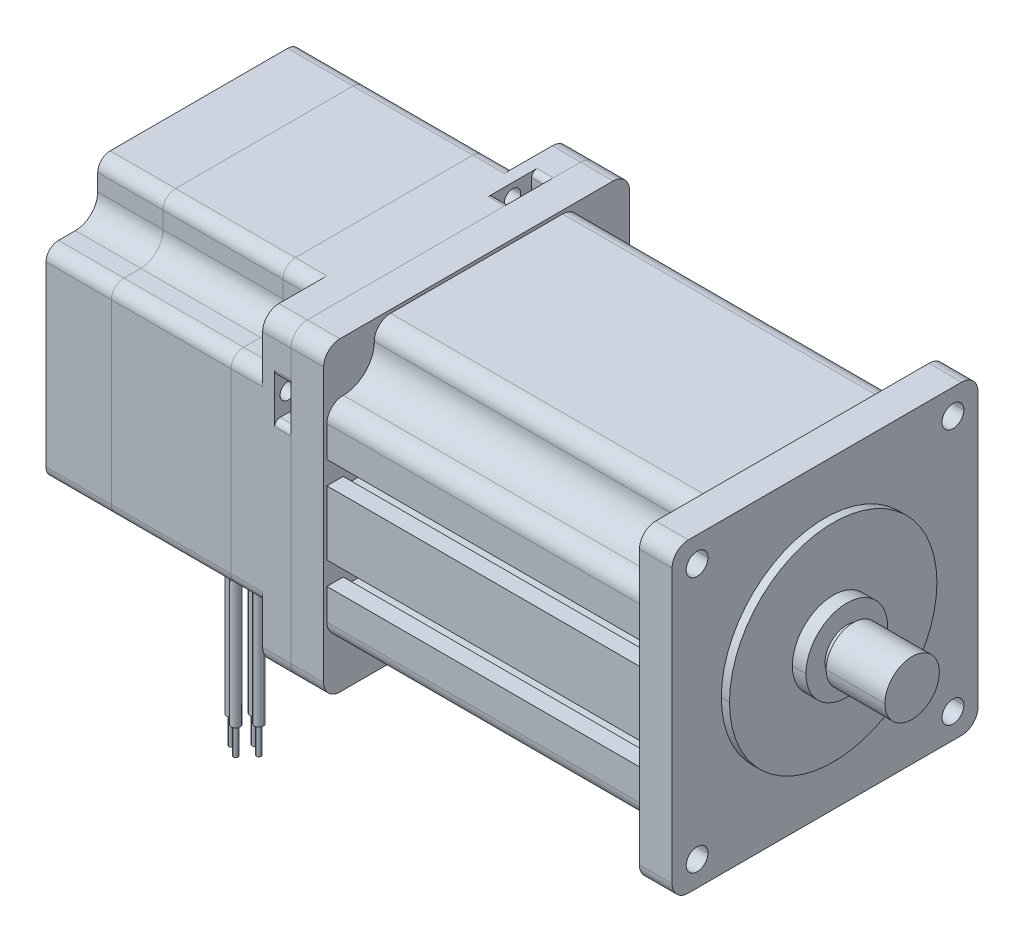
SolidWorks part; units mm, degrees
ref_plane "Front" through (0, 0, 0) normal (0, 0, 1) x (1, 0, 0)
ref_plane "Top" through (0, 0, 0) normal (0, 1, 0) x (1, 0, 0)
ref_plane "Right" through (0, 0, 0) normal (1, 0, 0) x (0, 0, -1)
imported_body "Imported1"
imported_body "Imported2"
imported_body "Imported3"
imported_body "Imported4"
surface "Surface-Plane1"
split "Split1" trim tools "Surface-Plane1" bodies to split 105 107 106 104 resulting bodies 109 110 111 112 113
move or copy body "Body-Move/Copy1" bodies to move or copy 112 placed by mates yes parameters "D1"=0, "D2"=0, "D3"=0
other "Distance1" parameters "D1"=58
sketch "Sketch1" plane through (22.6491, 0, 0) normal (1, 0, 0) x (0, 0, -1)
  line L36 (-39.9658, 49.7932) -> (-36.9658, 49.7932)
  line L37 (-36.9658, 49.7932) -> (-36.9658, 42.5932)
  line L38 (-36.9658, 42.5932) -> (-39.9658, 42.5932)
  line L39 (-39.9658, 42.5932) -> (-39.9658, 44.0932)
  line L40 (-39.9658, 44.0932) -> (-42.9658, 44.0932)
  line L41 (-42.9658, 44.0932) -> (-42.9658, 32.2932)
  line L42 (-42.9658, 32.2932) -> (-39.9658, 32.2932)
  line L43 (-39.9658, 32.2932) -> (-39.9658, 33.7932)
  line L44 (-39.9658, 33.7932) -> (-36.9658, 33.7932)
  line L45 (-36.9658, 33.7932) -> (-36.9658, 26.5932)
  line L46 (-36.9658, 26.5932) -> (-39.9658, 26.5932)
  line L47 (-39.9658, 26.5932) -> (-39.9658, 28.0932)
  line L48 (-39.9658, 28.0932) -> (-42.9658, 28.0932)
  line L49 (-42.9658, 28.0932) -> (-42.9658, 22.3932)
  line L50 (-31.2658, 10.6932) -> (0.3342, 10.6932)
  line L51 (12.0342, 22.3932) -> (12.0342, 28.0932)
  line L52 (12.0342, 28.0932) -> (9.0342, 28.0932)
  line L53 (9.0342, 28.0932) -> (9.0342, 26.5932)
  line L54 (9.0342, 26.5932) -> (6.0342, 26.5932)
  line L55 (6.0342, 26.5932) -> (6.0342, 33.7932)
  line L56 (6.0342, 33.7932) -> (9.0342, 33.7932)
  line L57 (9.0342, 33.7932) -> (9.0342, 32.2932)
  line L58 (9.0342, 32.2932) -> (12.0342, 32.2932)
  line L59 (12.0342, 32.2932) -> (12.0342, 44.0932)
  line L60 (12.0342, 44.0932) -> (9.0342, 44.0932)
  line L61 (9.0342, 44.0932) -> (9.0342, 42.5932)
  line L62 (9.0342, 42.5932) -> (6.0342, 42.5932)
  line L63 (6.0342, 42.5932) -> (6.0342, 49.7932)
  line L64 (6.0342, 49.7932) -> (9.0342, 49.7932)
  line L65 (9.0342, 49.7932) -> (9.0342, 48.2932)
  line L66 (9.0342, 48.2932) -> (12.0342, 48.2932)
  line L67 (12.0342, 48.2932) -> (12.0342, 53.9932)
  line L68 (0.3342, 65.6932) -> (-31.2658, 65.6932)
  line L69 (-42.9658, 53.9932) -> (-42.9658, 48.2932)
  line L70 (-42.9658, 48.2932) -> (-39.9658, 48.2932)
  line L71 (-39.9658, 48.2932) -> (-39.9658, 49.7932)
  line L72 (-39.9658, 49.7932) -> (-36.9658, 49.7932)
  line L73 (-36.9658, 49.7932) -> (-36.9658, 42.5932)
  line L74 (-36.9658, 42.5932) -> (-39.9658, 42.5932)
  line L75 (-39.9658, 42.5932) -> (-39.9658, 44.0932)
  line L76 (-39.9658, 44.0932) -> (-42.9658, 44.0932)
  line L77 (-42.9658, 44.0932) -> (-42.9658, 32.2932)
  line L78 (-42.9658, 32.2932) -> (-39.9658, 32.2932)
  line L79 (-39.9658, 32.2932) -> (-39.9658, 33.7932)
  line L80 (-39.9658, 33.7932) -> (-36.9658, 33.7932)
  line L81 (-36.9658, 33.7932) -> (-36.9658, 26.5932)
  line L82 (-36.9658, 26.5932) -> (-39.9658, 26.5932)
  line L83 (-39.9658, 26.5932) -> (-39.9658, 28.0932)
  line L84 (-39.9658, 28.0932) -> (-42.9658, 28.0932)
  line L85 (-42.9658, 28.0932) -> (-42.9658, 22.3932)
  line L86 (-31.2658, 10.6932) -> (0.3342, 10.6932)
  line L87 (12.0342, 22.3932) -> (12.0342, 28.0932)
  line L88 (12.0342, 28.0932) -> (9.0342, 28.0932)
  line L89 (9.0342, 28.0932) -> (9.0342, 26.5932)
  line L90 (9.0342, 26.5932) -> (6.0342, 26.5932)
  line L91 (6.0342, 26.5932) -> (6.0342, 33.7932)
  line L92 (6.0342, 33.7932) -> (9.0342, 33.7932)
  line L93 (9.0342, 33.7932) -> (9.0342, 32.2932)
  line L94 (9.0342, 32.2932) -> (12.0342, 32.2932)
  line L95 (12.0342, 32.2932) -> (12.0342, 44.0932)
  line L96 (12.0342, 44.0932) -> (9.0342, 44.0932)
  line L97 (9.0342, 44.0932) -> (9.0342, 42.5932)
  line L98 (9.0342, 42.5932) -> (6.0342, 42.5932)
  line L99 (6.0342, 42.5932) -> (6.0342, 49.7932)
  line L100 (6.0342, 49.7932) -> (9.0342, 49.7932)
  line L101 (9.0342, 49.7932) -> (9.0342, 48.2932)
  line L102 (9.0342, 48.2932) -> (12.0342, 48.2932)
  line L103 (12.0342, 48.2932) -> (12.0342, 53.9932)
  line L104 (0.3342, 65.6932) -> (-31.2658, 65.6932)
  line L105 (-42.9658, 53.9932) -> (-42.9658, 48.2932)
  line L106 (-42.9658, 48.2932) -> (-39.9658, 48.2932)
  line L107 (-39.9658, 48.2932) -> (-39.9658, 49.7932)
  arc A12 (-42.9658, 22.3932) -> (-39.9658, 19.3932) centre (-39.9658, 22.3932) ccw
  arc A13 (-34.2658, 13.6932) -> (-39.9658, 19.3932) centre (-39.9658, 13.6932) ccw
  arc A14 (-34.2658, 13.6932) -> (-31.2658, 10.6932) centre (-31.2658, 13.6932) ccw
  arc A15 (0.3342, 10.6932) -> (3.3342, 13.6932) centre (0.3342, 13.6932) ccw
  arc A16 (9.0342, 19.3932) -> (3.3342, 13.6932) centre (9.0342, 13.6932) ccw
  arc A17 (9.0342, 19.3932) -> (12.0342, 22.3932) centre (9.0342, 22.3932) ccw
  arc A18 (12.0342, 53.9932) -> (9.0342, 56.9932) centre (9.0342, 53.9932) ccw
  arc A19 (3.3342, 62.6932) -> (9.0342, 56.9932) centre (9.0342, 62.6932) ccw
  arc A20 (3.3342, 62.6932) -> (0.3342, 65.6932) centre (0.3342, 62.6932) ccw
  arc A21 (-31.2658, 65.6932) -> (-34.2658, 62.6932) centre (-31.2658, 62.6932) ccw
  arc A22 (-39.9658, 56.9932) -> (-34.2658, 62.6932) centre (-39.9658, 62.6932) ccw
  arc A23 (-39.9658, 56.9932) -> (-42.9658, 53.9932) centre (-39.9658, 53.9932) ccw
  arc A24 (-42.9658, 22.3932) -> (-39.9658, 19.3932) centre (-39.9658, 22.3932) ccw
  arc A25 (-34.2658, 13.6932) -> (-39.9658, 19.3932) centre (-39.9658, 13.6932) ccw
  arc A26 (-34.2658, 13.6932) -> (-31.2658, 10.6932) centre (-31.2658, 13.6932) ccw
  arc A27 (0.3342, 10.6932) -> (3.3342, 13.6932) centre (0.3342, 13.6932) ccw
  arc A28 (9.0342, 19.3932) -> (3.3342, 13.6932) centre (9.0342, 13.6932) ccw
  arc A29 (9.0342, 19.3932) -> (12.0342, 22.3932) centre (9.0342, 22.3932) ccw
  arc A30 (12.0342, 53.9932) -> (9.0342, 56.9932) centre (9.0342, 53.9932) ccw
  arc A31 (3.3342, 62.6932) -> (9.0342, 56.9932) centre (9.0342, 62.6932) ccw
  arc A32 (3.3342, 62.6932) -> (0.3342, 65.6932) centre (0.3342, 62.6932) ccw
  arc A33 (-31.2658, 65.6932) -> (-34.2658, 62.6932) centre (-31.2658, 62.6932) ccw
  arc A34 (-39.9658, 56.9932) -> (-34.2658, 62.6932) centre (-39.9658, 62.6932) ccw
  arc A35 (-39.9658, 56.9932) -> (-42.9658, 53.9932) centre (-39.9658, 53.9932) ccw
  dimension "D1" = 0
extrude "Boss-Extrude1" add sketch "Sketch1" along normal up to surface (12.3 mm away)
